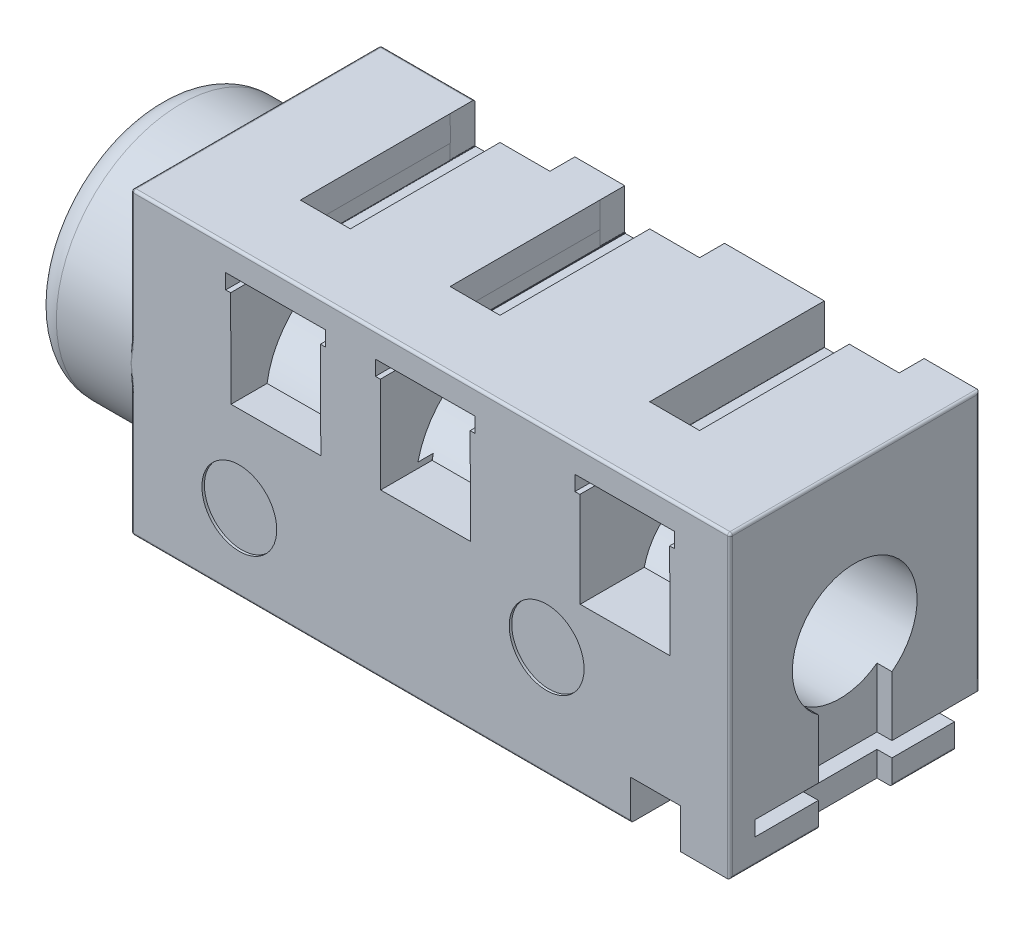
SolidWorks part; units mm, degrees
ref_plane "前视基准面" through (0, 0, 0) normal (0, 0, 1) x (1, 0, 0)
ref_plane "上视基准面" through (0, 0, 0) normal (0, 1, 0) x (1, 0, 0)
ref_plane "右视基准面" through (0, 0, 0) normal (1, 0, 0) x (0, 0, -1)
sketch "草图1" plane through (0, 0, 0) normal (0, 0, 1) x (1, 0, 0)
  line L1 (-6, 3) -> (6, 3)
  line L2 (-6, 3) -> (-6, -3)
  line L3 (-6, -3) -> (6, -3)
  line L4 (6, 3) -> (6, -3)
  line L5 (-6, 3) -> (6, -3) construction
  line L6 (-6, -3) -> (6, 3) construction
  point P0 (0, 0)
  dimension "D1" = 12
  dimension "D2" = 6
extrude "凸台-拉伸1" add sketch "草图1" along normal blind 5 contours L1 L4 L3 L2
sketch "草图2" plane through (-6, 0, 0) normal (-1, 0, 0) x (0, 0, 1)
  line L0 (5, -0.0472) -> (0, 0) construction
  line L1 (5, 3) -> (5, -3) construction
  circle A0 centre (2.5, -0.0236) radius 1.8
  dimension "D1" = 3.6
extrude "拉伸-薄壁1" add sketch "草图2" along normal blind 2 thin
sketch "草图3" plane through (-6, 0, 0) normal (-1, 0, 0) x (0, 0, 1)
  line L0 (4.3, -0.0236) -> (0.7, -0.0236) construction
  circle A0 centre (2.5, -0.0236) radius 1.8 construction
  circle A1 centre (2.5, -0.0236) radius 1.8 construction
  circle A2 centre (2.5, -0.0236) radius 1.8
  dimension "D1" = 3.6
extrude "切除-拉伸1" cut sketch "草图3" against normal blind 5
sketch "草图11" plane through (-1, 0, 0) normal (-1, 0, 0) x (0, 0, 1)
  line L0 (4.3, -0.0236) -> (0.7, -0.0236) construction
  circle A0 centre (2.5, -0.0236) radius 1.8 construction
  circle A1 centre (2.5, -0.0236) radius 1.8 construction
  circle A2 centre (2.5, -0.0236) radius 1.5
  dimension "D1" = 3
extrude "切除-拉伸7" cut sketch "草图11" against normal blind 3
sketch "草图4" plane through (0, 0, 0) normal (0, 0, -1) x (-1, 0, 0)
  line L0 (6, -0.0236) -> (-6, 0) construction
  line L1 (-6, 3) -> (-6, -3) construction
  circle A0 centre (4.5, -0.0207) radius 0.4
  circle A1 centre (-2.5, -0.0069) radius 0.4
  dimension "D1" = 0.8
  dimension "D2" = 7
  dimension "D3" = 1.5
extrude "凸台-拉伸2" add sketch "草图4" along normal blind 1
sketch "草图5" plane through (0, 0, 0) normal (0, 0, -1) x (-1, 0, 0)
  line L0 (-2.8913, 3) -> (-4.8913, 3)
  line L5 (6, -0.0236) -> (-6, 0) construction
  line L14 (-6, 3) -> (-6, -3) construction
  line L19 (-4.8913, 3) -> (-4.8913, 2.1989)
  line L40 (-2.8913, 2.1989) -> (-4.8913, 2.1989)
  line L41 (-2.8913, 3) -> (-2.8913, 2.1989)
  line L46 (1.1087, 3) -> (-0.8913, 3)
  line L47 (-0.8913, 3) -> (-0.8913, 2.2)
  line L48 (1.1087, 2.2) -> (-0.8913, 2.2)
  line L49 (1.1087, 3) -> (1.1087, 2.2)
  line L50 (2.1087, 3) -> (2.1087, 2.2)
  line L51 (4.1087, 3) -> (2.1087, 3)
  line L52 (4.1087, 2.2) -> (2.1087, 2.2)
  line L53 (4.1087, 3) -> (4.1087, 2.2)
  line L54 (-6.0118, -3) -> (-6.0087, -2.2)
  line L55 (-6.0087, -2.2) -> (-4.0087, -2.2079)
  line L56 (-6.0118, -3) -> (-4.0118, -3.0079)
  line L57 (-4.0118, -3.0079) -> (-4.0087, -2.2079)
  line L58 (6, 3) -> (-6, 3) construction
  dimension "D1" = 2
extrude "切除-拉伸2" cut sketch "草图5" against normal blind 0.5
sketch "草图7" plane through (0, 0, 0) normal (0, 0, -1) x (-1, 0, 0)
  line L2 (-3.8913, 2.1989) -> (-3.8913, 3)
  line L3 (-3.8913, 2.1989) -> (-2.8913, 2.1989)
  line L5 (-2.8913, 2.1989) -> (-2.8913, 3)
  line L8 (0.1087, 3) -> (1.1087, 3)
  line L13 (0.1, 2.1768) -> (0.1087, 3)
  line L16 (0.1, 2.1768) -> (1.0969, 2.1768)
  line L21 (1.0969, 2.1768) -> (1.1087, 3)
  line L24 (3.1087, 3) -> (4.1087, 3)
  line L26 (6, -0.0236) -> (-6, -0.0236) construction
  line L27 (3.0999, 2.1886) -> (3.1087, 3)
  line L37 (3.0999, 2.1886) -> (4.0969, 2.1886)
  line L38 (4.0969, 2.1886) -> (4.1087, 3)
  line L41 (-3.8913, 3) -> (-2.8913, 3)
  line L43 (-6, 3) -> (-6, -2.2) construction
  line L83 (4.1087, 3) -> (2.1087, 3) construction
  line L84 (1.1087, 3) -> (-0.8913, 3) construction
  line L87 (-2.8913, 2.1989) -> (-2.8913, 3) construction
  line L88 (-4.8913, 2.1989) -> (-2.8913, 2.1989) construction
  line L89 (-2.8913, 2.1989) -> (-2.8913, 3) construction
  line L90 (-2.8913, 3) -> (-4.8913, 3) construction
extrude "切除-拉伸3" cut sketch "草图7" against normal blind 3.5
sketch "草图8" plane through (6, 0, 0) normal (1, 0, 0) x (0, 0, -1)
  line L0 (-5, 0) -> (0, 0) construction
  line L1 (-5, 3) -> (-5, -3) construction
  circle A0 centre (-2.5, 0) radius 1.25
  dimension "D1" = 2.5
extrude "切除-拉伸4" cut sketch "草图8" against normal blind 5
sketch "草图10" plane through (0, 0, 0) normal (0, 0, -1) x (-1, 0, 0)
  line L15 (6, -0.0236) -> (-2.5, -0.0069) construction
  line L17 (-4.8913, 2.1989) -> (-4.8902, 2.4989)
  line L18 (-4.8902, 2.4989) -> (-2.8913, 2.4911)
  line L19 (-4.8913, 2.1989) -> (-2.8925, 2.1911)
  line L20 (-2.8925, 2.1911) -> (-2.8913, 2.4911)
  line L21 (-0.8913, 2.2) -> (-0.8902, 2.5)
  line L22 (-0.8902, 2.5) -> (1.1068, 2.4921)
  line L23 (-0.8913, 2.2) -> (1.1056, 2.1921)
  line L24 (1.1056, 2.1921) -> (1.1068, 2.4921)
  line L25 (2.1087, 2.2) -> (2.1098, 2.5)
  line L26 (4.1056, 2.1921) -> (4.1068, 2.4921)
  line L27 (2.1087, 2.2) -> (4.1056, 2.1921)
  line L28 (2.1098, 2.5) -> (4.1068, 2.4921)
extrude "切除-拉伸6" cut sketch "草图10" against normal through all
sketch "草图9" plane through (0, 0, 5) normal (0, 0, 1) x (1, 0, 0)
  line L13 (-4.5, -0.0207) -> (2.5, -0.0069) construction
  line L20 (2.991, 2.2882) -> (4.791, 2.2953)
  line L21 (4.7988, 0.2953) -> (4.791, 2.2953)
  line L22 (2.9988, 0.2882) -> (4.7988, 0.2953)
  line L23 (2.9988, 0.2882) -> (2.991, 2.2882)
  line L24 (-1.0074, 2.2724) -> (0.7925, 2.2795)
  line L25 (0.8004, 0.2795) -> (0.7925, 2.2795)
  line L26 (-0.9996, 0.2724) -> (0.8004, 0.2795)
  line L27 (-0.9996, 0.2724) -> (-1.0074, 2.2724)
  line L28 (-2.1996, 0.2677) -> (-2.2074, 2.2677)
  line L29 (-4.0074, 2.2606) -> (-2.2074, 2.2677)
  line L30 (-3.9995, 0.2606) -> (-2.1996, 0.2677)
  line L31 (-3.9995, 0.2606) -> (-4.0074, 2.2606)
  line L32 (-3.8158, 1.2614) -> (5.5598, 1.2983) construction
  line L33 (3.8902, 2.495) -> (3.9053, -1.3365) construction
  line L34 (-0.1083, 2.4961) -> (-0.0973, -0.3101) construction
  line L35 (-3.1083, 2.4961) -> (-3.0962, -0.5872) construction
extrude "切除-拉伸5" cut sketch "草图9" against normal blind 2
sketch "草图13" plane through (0, 0, 0) normal (0, 0, -1) x (-1, 0, 0)
  line L5 (4.5, -0.0207) -> (-2.5, -0.0069) construction
  line L6 (-6.0098, -2.5) -> (-6.0087, -2.2)
  line L7 (-4.0087, -2.2079) -> (-6.0087, -2.2)
  line L8 (-4.0099, -2.5079) -> (-6.0098, -2.5)
  line L9 (-4.0099, -2.5079) -> (-4.0087, -2.2079)
extrude "切除-拉伸9" cut sketch "草图13" against normal blind 4.5
sketch "草图12" plane through (0, 0, 5) normal (0, 0, 1) x (1, 0, 0)
  line L5 (-6, -0.0236) -> (6, 0) construction
  line L6 (6, 3) -> (6, -3) construction
  line L7 (4.0118, -3.0079) -> (5.0118, -3.0039)
  line L8 (5.0087, -2.2039) -> (5.0118, -3.0039)
  line L9 (4.0087, -2.2079) -> (5.0087, -2.2039)
  line L10 (4.0087, -2.2079) -> (4.0118, -3.0079)
extrude "切除-拉伸8" cut sketch "草图12" against normal blind 2
fillet "圆角1" radius 0.3 2 edges at (2.1, -0.0069, -1) (-4.9, -0.0207, -1)
sketch "草图14" plane through (0, 0, 5) normal (0, 0, 1) x (1, 0, 0)
  circle A0 centre (-3.8332, -1.4592) radius 0.75
  circle A1 centre (2.3259, -0.7959) radius 0.75
  dimension "D1" = 1.5
  dimension "D2" = 1.5
extrude "切除-拉伸10" cut sketch "草图14" against normal blind 0.05
fillet "圆角2" radius 0.05 12 edges at (6, 0, 5) (0, 3, 5) (-6, -1.5118, 0) (-6, -1.5118, 5) (-6, 1.4882, 5) (6, 0.4, 0) (-0.9941, -3, 0) (-6, 1.4882, 0) (-6, 3, 2.5) (6, 3, 2.5) (6, -3, 2.75) (-6, -3, 2.5)
sketch "草图15" plane through (6, 0, 0) normal (1, 0, 0) x (0, 0, -1)
  line L0 (-2.4914, 0) -> (-2.4914, 1.25) construction
  line L2 (-1.7543, -0.1053) -> (-3.2285, -0.1053)
  line L3 (-1.7543, -0.1053) -> (-1.7543, -3.2266)
  line L12 (-1.7543, -3.2266) -> (-3.2285, -3.2266)
  line L13 (-3.2285, -0.1053) -> (-3.2285, -3.2266)
  line L14 (-3.799, 0) -> (-1.1838, 0) construction
  line L15 (-1.7543, -0.1053) -> (-3.2285, -3.2266) construction
  line L16 (-1.7543, -3.2266) -> (-3.2285, -0.1053) construction
  circle A0 centre (-2.5, 0) radius 1.25 construction
  point P5 (-2.4914, -1.666)
extrude "切除-拉伸11" cut sketch "草图15" against normal blind 0.3
fillet "圆角3" radius 0.5 1 edges at (-8, -0.0236, 5)
